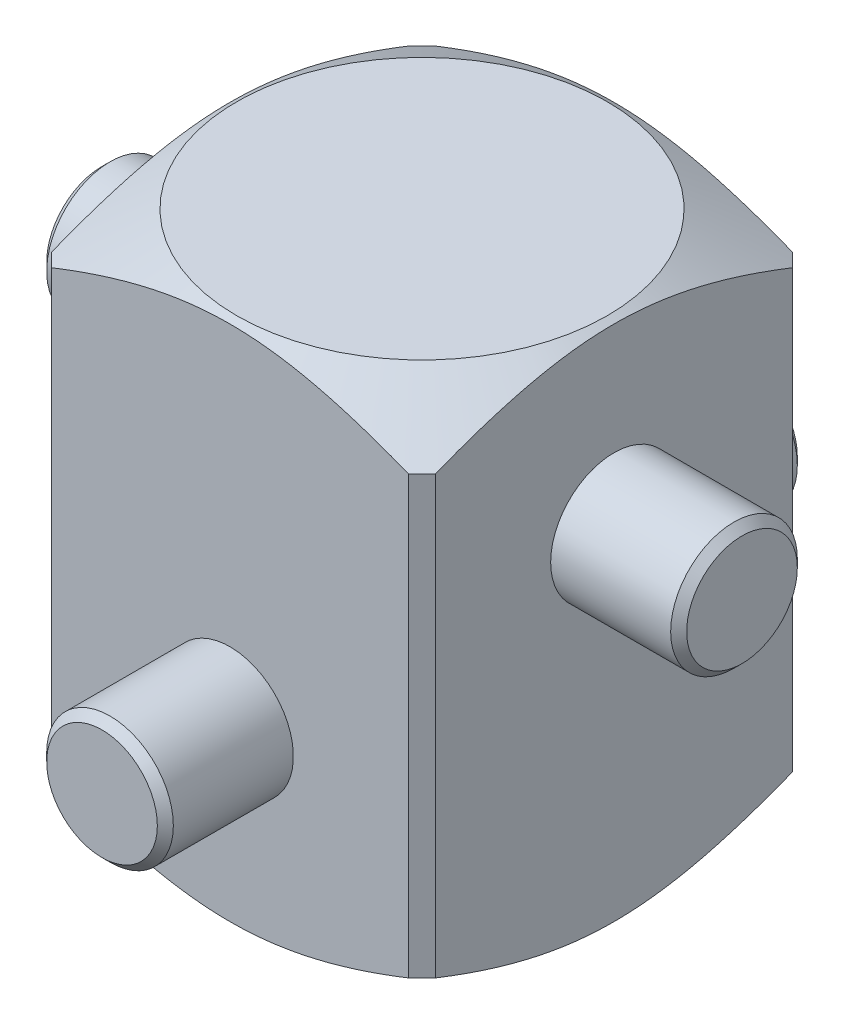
SolidWorks part; units mm, degrees
ref_plane "Front Plane" through (0, 0, 0) normal (0, 0, 1) x (1, 0, 0)
ref_plane "Top Plane" through (0, 0, 0) normal (0, 1, 0) x (1, 0, 0)
ref_plane "Right Plane" through (0, 0, 0) normal (1, 0, 0) x (0, 0, -1)
sketch "Sketch1" plane through (0, 0, 0) normal (0, 1, 0) x (1, 0, 0)
  line L1 (-7.2, 7.2) -> (7.2, 7.2)
  line L2 (-7.2, 7.2) -> (-7.2, -7.2)
  line L3 (-7.2, -7.2) -> (7.2, -7.2)
  line L4 (7.2, 7.2) -> (7.2, -7.2)
  line L5 (-7.2, 7.2) -> (7.2, -7.2) construction
  line L6 (-7.2, -7.2) -> (7.2, 7.2) construction
  point P0 (0, 0)
  dimension "D1" = 14.4
extrude "Boss-Extrude1" add sketch "Sketch1" along normal blind 19.7
ref_axis "Axis1" through (0, 20.685, 0) along (0, -1, 0)
sketch "Sketch2" plane through (0, 0, 0) normal (0, 0, 1) x (1, 0, 0)
  line L0 (-6.95, 19.7) -> (-16.09, 19.7)
  line L1 (-7.2, 19.7) -> (7.2, 19.7) construction
  line L2 (-16.09, 19.7) -> (-16.09, 0)
  line L3 (-16.09, 0) -> (-6.95, 0)
  line L4 (-7.2, 0) -> (7.2, 0) construction
  line L5 (-6.95, 19.7) -> (-13.55, 15.8895)
  line L6 (-13.55, 15.8895) -> (-13.55, 3.8105)
  line L7 (-13.55, 3.8105) -> (-6.95, 0)
  line L8 (-7.2, 19.7) -> (-7.2, 0) construction
  point P10 (-13.55, 9.85)
  point P13 (-7.2, 9.85)
  dimension "D1" = 0.25
  dimension "D2" = 6.35
  dimension "D3" = 2.54
  dimension "D4" = 30
  dimension "D5" = 30
revolve "Cut-Revolve1" cut sketch "Sketch2" angle 360 about axis through (0, 20.685, 0) along (0, -1, 0)
sketch "Sketch3" plane through (0, 0, 0) normal (0, 0, 1) x (1, 0, 0)
  line L0 (0, 20.685) -> (0, -0.985) construction
  circle A0 centre (0, 6.7) radius 2.375
  dimension "D1" = 4.75
  dimension "D2" = 6.7
extrude "Boss-Extrude2" add sketch "Sketch3" along normal mid plane 24
sketch "Sketch4" plane through (0, 0, 0) normal (1, 0, 0) x (0, 0, -1)
  line L0 (0, 20.685) -> (0, -0.985) construction
  line L1 (6.95, 19.7) -> (-6.95, 19.7) construction
  circle A0 centre (0, 13) radius 2.375
  dimension "D1" = 4.75
  dimension "D2" = 6.7
extrude "Boss-Extrude3" add sketch "Sketch4" along normal mid plane 24
chamfer "Chamfer1" distance 0.3 angle 45 4 edges at (2.375, 6.7, -12) (-12, 13, -2.375) (12, 13, -2.375) (2.375, 6.7, 12)
chamfer "Chamfer2" distance 0.5 angle 45 4 edges at (7.2, 9.85, 7.2) (7.2, 9.85, -7.2) (-7.2, 9.85, 7.2) (-7.2, 9.85, -7.2)
